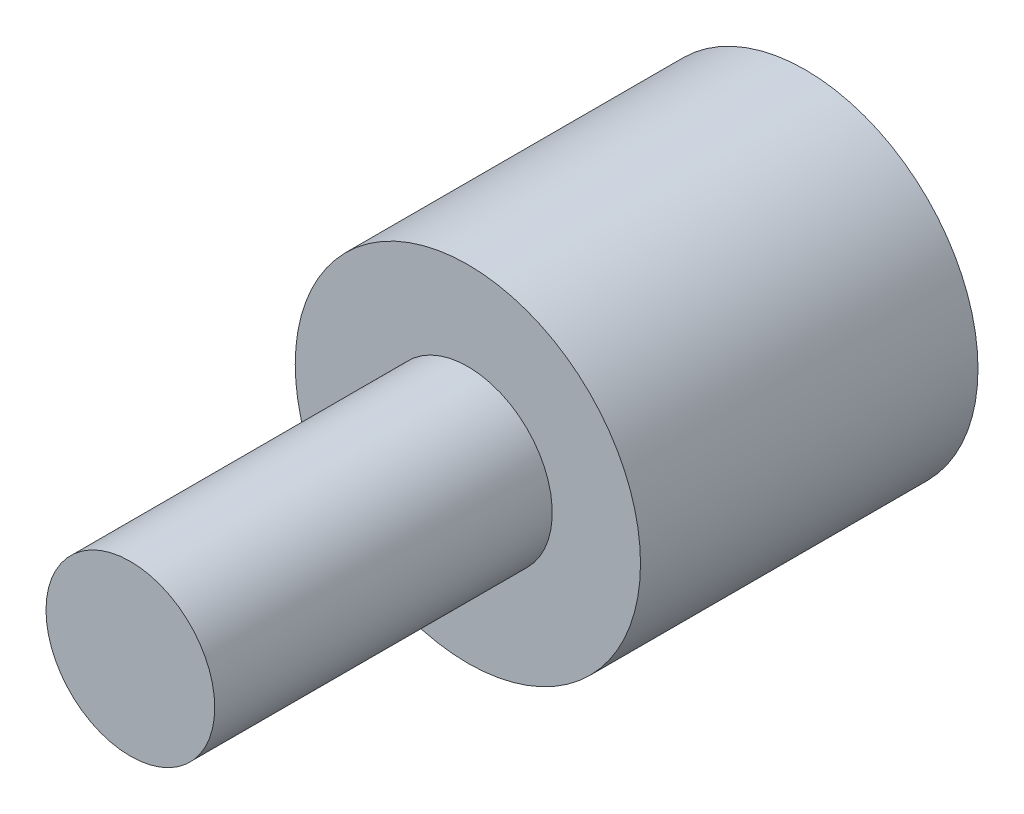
SolidWorks part; units mm, degrees
ref_plane "Vorderansicht" through (0, 0, 0) normal (0, 0, 1) x (1, 0, 0)
ref_plane "Draufsicht" through (0, 0, 0) normal (0, 1, 0) x (1, 0, 0)
ref_plane "Seitenansicht" through (0, 0, 0) normal (1, 0, 0) x (0, 0, -1)
sketch "Skizze1" plane through (0, 0, 0) normal (0, 0, 1) x (1, 0, 0)
  circle A0 centre (0, 0) radius 2.5
  dimension "D1" = 5
extrude "Linear austragen1" add sketch "Skizze1" along normal blind 10
sketch "Skizze2" plane through (0, 0, 0) normal (0, 0, -1) x (-1, 0, 0)
  circle A0 centre (0, 0) radius 5.1153
  circle A1 centre (0, 0) radius 2.5 construction
extrude "Linear austragen2" add sketch "Skizze2" along normal blind 10
